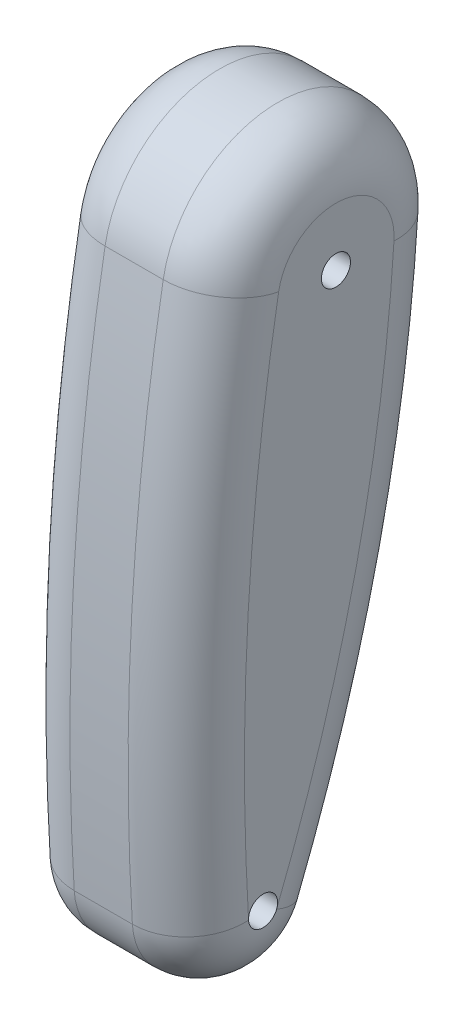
SolidWorks part; units mm, degrees
ref_plane "XY" through (0, 0, 0) normal (0, 0, 1) x (1, 0, 0)
ref_plane "YZ" through (0, 0, 0) normal (0, 1, 0) x (1, 0, 0)
ref_plane "XZ" through (0, 0, 0) normal (1, 0, 0) x (0, 0, -1)
sketch "Sketch6" plane through (0, 0, 0) normal (1, 0, 0) x (0, 0, -1)
  line L0 (-63.6299, -452.7506) -> (0, 0) construction
  line L1 (0, 432.2232) -> (0, -432.2232) construction
  arc A0 (101.3966, -6.4257) -> (-100.0676, 17.5792) centre (0, 0) ccw
  arc A1 (-127.0143, -456.5811) -> (-4.6768, -476.3467) centre (-63.6299, -452.7506) ccw
  arc A2 (-127.0143, -456.5811) -> (-100.0676, 17.5792) centre (1901.2852, -334.0041) cw
  arc A3 (101.3966, -6.4257) -> (-4.6768, -476.3467) centre (-1419.5524, 89.9598) cw
  dimension "D3" = 101.6
  dimension "D4" = 1524
  dimension "D5" = 2032
  dimension "D6" = 63.5
  dimension "D1" = 457.2
  dimension "D2" = 8
extrude "Base-Extrude" add sketch "Sketch6" along normal mid plane 152.4
fillet "Fillet1" radius 50.8 8 edges at (76.2, -245.604, -67.0454) (76.2, 100.8864, -12.0208) (76.2, -218.711, 127.4414) (-76.2, 100.8864, -12.0208) (-76.2, -245.604, -67.0454) (-76.2, -515.4377, 73.758) (-76.2, -218.711, 127.4414) (76.2, -515.4377, 73.758)
sketch "Sketch7" plane through (-76.2, 0, 0) normal (-1, 0, 0) x (0, 0, 1)
  circle A0 centre (0, 0) radius 12.7
  circle A1 centre (63.6299, -452.7506) radius 12.7
  arc A2 (51.8393, -457.4698) -> (76.3068, -453.5167) centre (63.6299, -452.7506) ccw construction
  dimension "D1" = 25.4
extrude "Cut-Extrude1" cut sketch "Sketch7" against normal through all
